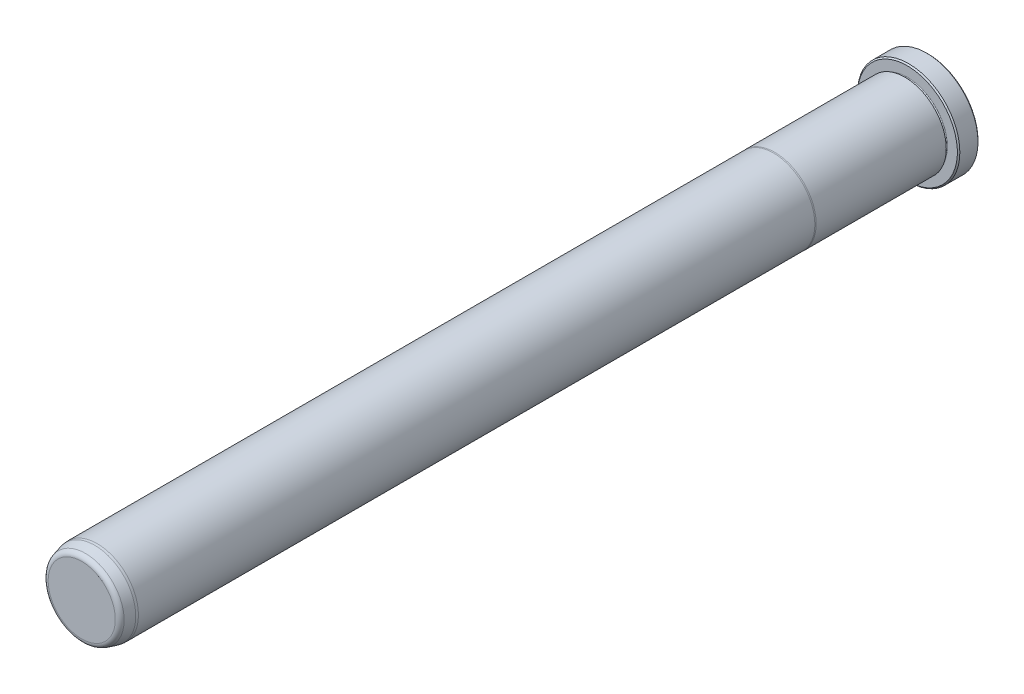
SolidWorks part; units mm, degrees
ref_plane "Front Plane" through (0, 0, 0) normal (0, 0, 1) x (1, 0, 0)
ref_plane "Top Plane" through (0, 0, 0) normal (0, 1, 0) x (1, 0, 0)
ref_plane "Right Plane" through (0, 0, 0) normal (1, 0, 0) x (0, 0, -1)
sketch "Sketch1" plane through (0, 0, 0) normal (1, 0, 0) x (0, 0, -1)
  line L0 (0, 0) -> (0, 15.748)
  line L1 (0, 15.748) -> (-6.35, 15.748)
  line L2 (-6.35, 15.748) -> (-6.35, 12.3063)
  line L3 (-6.35, 11.9253) -> (-7.112, 11.9253) construction
  line L4 (-7.112, 12.3063) -> (-7.112, 12.7127)
  line L5 (-7.112, 12.7127) -> (-47.1348, 12.7127)
  line L6 (-47.1348, 12.7127) -> (-47.498, 12.6873)
  line L7 (-47.498, 12.6873) -> (-255.5875, 12.6873)
  line L9 (-260.35, 11.5487) -> (-260.35, 0)
  line L10 (-260.35, 0) -> (0, 0)
  line L11 (0, 0) -> (13.6287, 0) construction
  line L12 (-255.5875, 12.6873) -> (-256.3495, 12.6206)
  line L13 (-256.3495, 12.6206) -> (-260.35, 11.5487)
  arc A0 (-7.112, 12.3063) -> (-6.35, 12.3063) centre (-6.731, 12.3063) ccw
  dimension "D14" = 0.762
  dimension "D1" = 6.35
  dimension "D2" = 0.762
  dimension "D3" = 31.496
  dimension "D4" = 25.4254
  dimension "D5" = 47.498
  dimension "D6" = 260.35
  dimension "D7" = 0.7874
  dimension "D8" = 4
  dimension "D9" = 25.3746
  dimension "D10" = 5
  dimension "D11" = 15
  dimension "D12" = 0.762
  dimension "D13" = 4.7625
revolve "Revolve1" add sketch "Sketch1" angle 360 about L11
fillet "Fillet6" radius 1.5875 1 edges at (11.5487, 0, 260.35)
chamfer "Chamfer1" distance 0.381 angle 45 2 edges at (15.748, 0, 0) (15.748, 0, 6.35)
